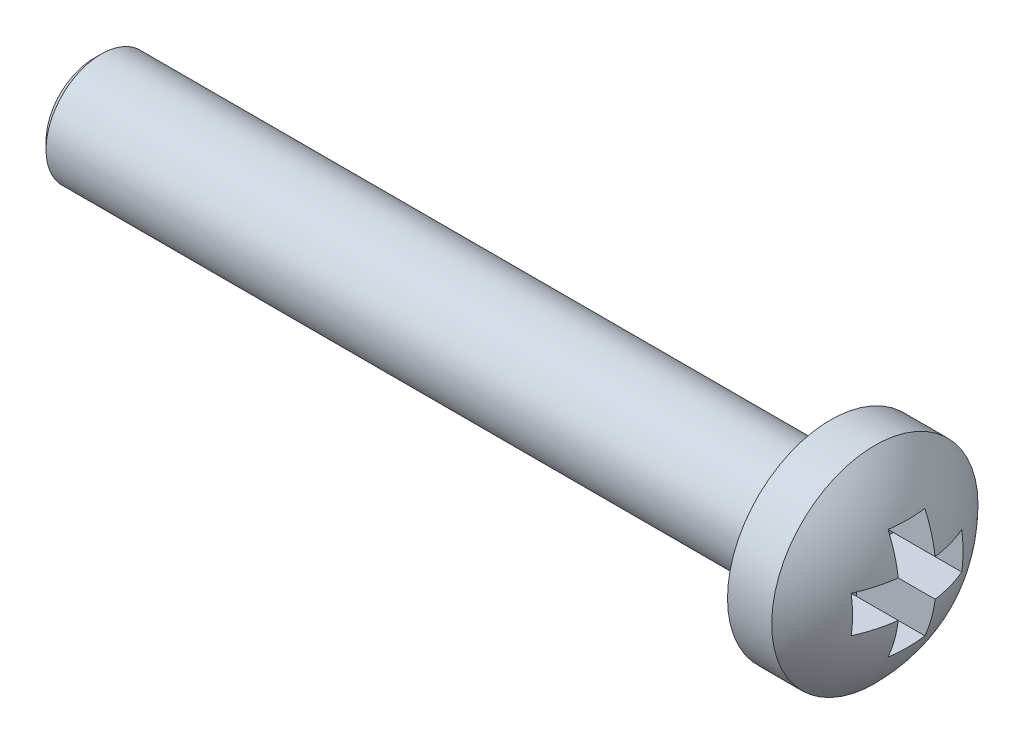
SolidWorks part; units mm, degrees
ref_plane "Plan de face" through (0, 0, 0) normal (0, 0, 1) x (1, 0, 0)
ref_plane "Plan de dessus" through (0, 0, 0) normal (0, 1, 0) x (1, 0, 0)
ref_plane "Plan de droite" through (0, 0, 0) normal (1, 0, 0) x (0, 0, -1)
sketch "Esquisse1" plane through (0, 0, 0) normal (0, 0, 1) x (1, 0, 0)
  line L0 (11.0618, 0) -> (-32.4908, 0) construction
  line L1 (0, 1.5) -> (0, 2.8)
  line L2 (0, 2.8) -> (1.2, 2.8)
  line L3 (0, 1.5) -> (-20, 1.5)
  line L4 (-20, 1.5) -> (-20, 0)
  line L5 (2.4, -1.2574) -> (2.4, 1.2574) construction
  line L6 (2.4, 0) -> (-20, 0)
  spline S0 degree 2 poles (1.2, 2.8) (2.4, 1.5717) (2.4, 0) knots 0 0 0 1 1 1
  dimension "D1" = 1.5
  dimension "D2" = 20
  dimension "D3" = 2.8
  dimension "D4" = 1.2
  dimension "D5" = 2.4
revolve "Révolution1" add sketch "Esquisse1" angle 360 about L0
chamfer "Chanfrein1" distance 0.2 angle 45 1 edges at (-20, 0, -1.5)
sketch "Esquisse2" plane through (0, 0, 0) normal (-1, 0, 0) x (0, 0, 1)
  line L0 (-0.5, 0.5) -> (-1.5, 0.5)
  line L1 (0.5, 1.5) -> (-0.5, 1.5)
  line L2 (0.5, 1.5) -> (0.5, 0.5)
  line L3 (0.5, -1.5) -> (-0.5, -1.5)
  line L4 (-0.5, 1.5) -> (-0.5, 0.5)
  line L5 (1.5, 0.5) -> (0.5, 0.5)
  line L6 (1.5, 0.5) -> (1.5, -0.5)
  line L7 (1.5, -0.5) -> (0.5, -0.5)
  line L8 (-1.5, 0.5) -> (-1.5, -0.5)
  line L9 (0.5, -0.5) -> (0.5, -1.5)
  line L10 (-0.5, -0.5) -> (-1.5, -0.5)
  line L11 (-0.5, -0.5) -> (-0.5, -1.5)
  dimension "D1" = 1
  dimension "D2" = 3
  dimension "D3" = 1.5
  dimension "D4" = 1.5
extrude "Enlèv. mat.-Extru.1" cut sketch "Esquisse2" along normal blind 2.2 from offset 2.4
